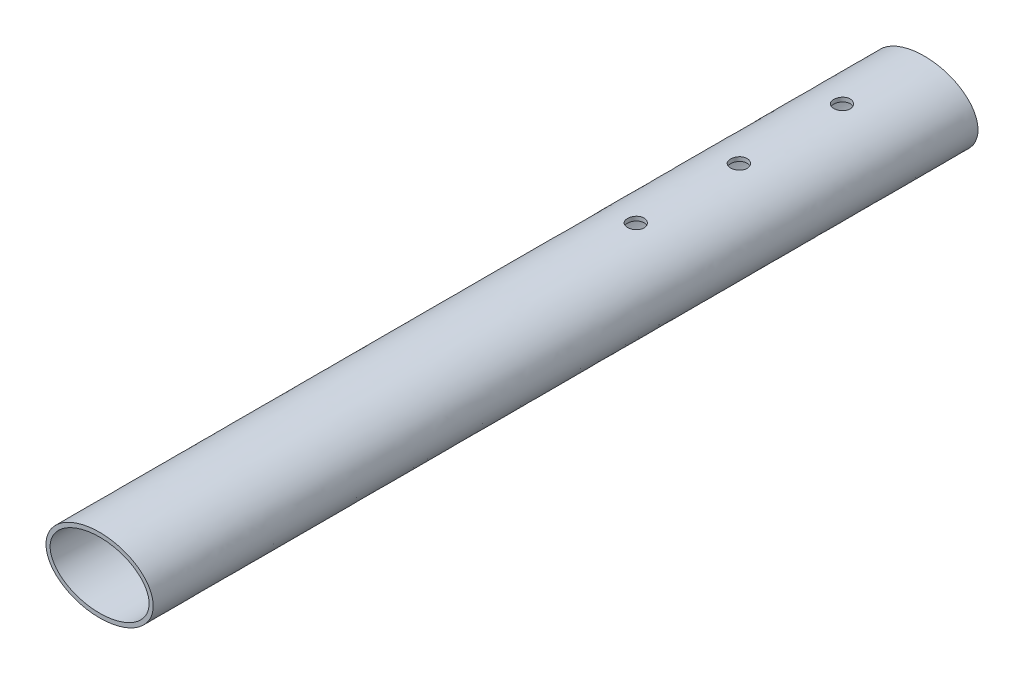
SolidWorks part; units mm, degrees
ref_plane "Front" through (0, 0, 0) normal (0, 0, 1) x (1, 0, 0)
ref_plane "Top" through (0, 0, 0) normal (0, 1, 0) x (1, 0, 0)
ref_plane "Right" through (0, 0, 0) normal (1, 0, 0) x (0, 0, -1)
sketch "草图1" plane through (0, 0, 0) normal (0, 0, 1) x (1, 0, 0)
  ellipse E0 centre (0, 0) end of major axis (-13, 0) minor radius 9
  point P8 (-12, 0)
  dimension "短直径" = 18
  dimension "长直径" = 26
  dimension "壁厚" = 1
extrude "凸台-拉伸1" add sketch "草图1" along normal blind 200
sketch "草图2" plane through (0, 0, 0) normal (0, 1, 0) x (1, 0, 0)
  circle A0 centre (0, -20) radius 2
  dimension "孔径" = 4
  dimension "端距" = 20
extrude "切除-拉伸1" cut sketch "草图2" against normal through all both and the other way through all
sketch "草图3" plane through (0, 0, 0) normal (0, 1, 0) x (1, 0, 0)
  line L0 (0, 0) -> (0, -112.8389) construction
pattern_linear "阵列(线性)1" count 3 spacing 25 along (0, 0, 1) of "切除-拉伸1"
